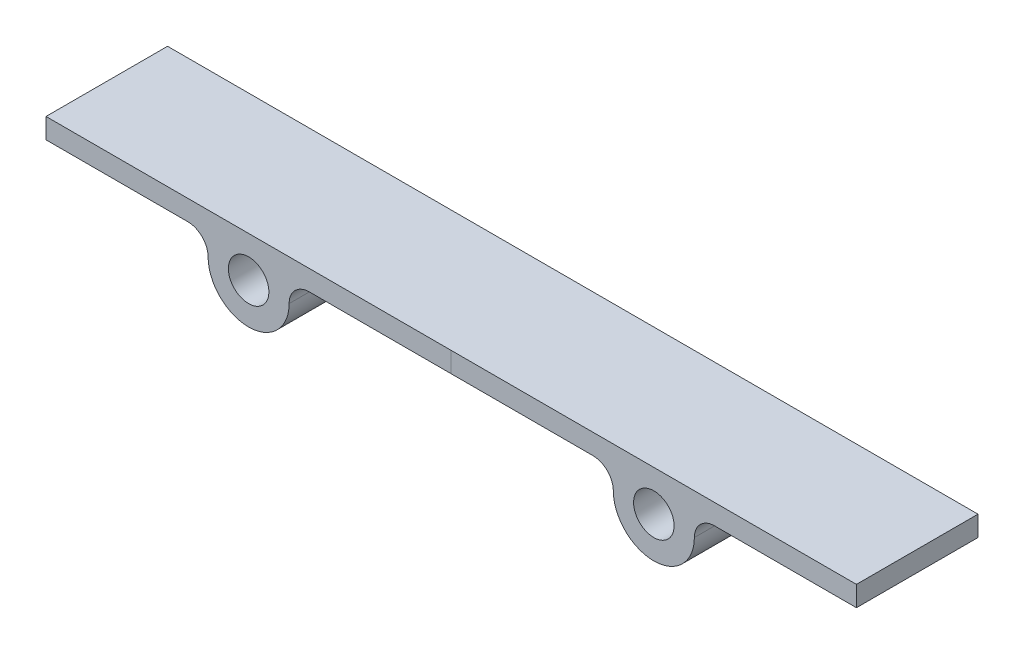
SolidWorks part; units mm, degrees
ref_plane "Front Plane" through (0, 0, 0) normal (0, 0, 1) x (1, 0, 0)
ref_plane "Top Plane" through (0, 0, 0) normal (0, 1, 0) x (1, 0, 0)
ref_plane "Right Plane" through (0, 0, 0) normal (1, 0, 0) x (0, 0, -1)
sketch "Sketch1" plane through (0, 0, 0) normal (0, 1, 0) x (1, 0, 0)
  line L0 (0, 0) -> (0, 95.1694) construction
  line L1 (0, 0) -> (117.2377, 0) construction
  line L3 (-200, 30) -> (200, 30)
  line L4 (-200, 30) -> (-200, -30)
  line L5 (-200, -30) -> (200, -30)
  line L6 (200, 30) -> (200, -30)
  dimension "D1" = 400
  dimension "D2" = 200
  dimension "D3" = 60
  dimension "D4" = 30
extrude "Extrude1" add sketch "Sketch1" against normal blind 10
sketch "Sketch2" plane through (0, -10, 0) normal (0, -1, 0) x (1, 0, 0)
  line L0 (0, 0) -> (-219.0879, 0) construction
  line L1 (-100, 30) -> (-100, -30) construction
  line L2 (-120, -30) -> (-80, -30)
  line L3 (-120, -30) -> (-120, 30)
  line L4 (-120, 30) -> (-80, 30)
  line L5 (-80, -30) -> (-80, 30)
  line L6 (0, 0) -> (0, -104.2356) construction
  line L7 (200, -30) -> (-200, -30) construction
  line L8 (-200, 30) -> (200, 30) construction
  dimension "D1" = 40
  dimension "D2" = 20
  dimension "D5" = 200
extrude "Extrude2" add sketch "Sketch2" along normal blind 30
fillet "Fillet1" radius 20 2 edges at (-80, -40, 0) (-120, -40, 0)
sketch "Sketch3" plane through (0, 0, -30) normal (0, 0, -1) x (1, 0, 0)
  circle A0 centre (-100, 20) radius 10
  arc A1 (-100, 40) -> (-120, 20) centre (-100, 20) ccw construction
  dimension "D1" = 20
extrude "Cut-Extrude1" cut sketch "Sketch3" against normal through all
fillet "Fillet2" radius 10 2 edges
mirror "Mirror1" about plane through (0, 0, 0) normal (1, 0, 0) of "Fillet2", "Extrude2", "Fillet1", "Cut-Extrude1"
sketch "Sketch4" plane through (0, 0, 0) normal (0, 1, 0) x (-1, 0, 0)
  line L0 (0, -30) -> (0, 30)
  line L1 (-200, -30) -> (200, -30) construction
  line L2 (200, 30) -> (-200, 30) construction
equation "\"D2@Sketch1\" = \"D1@Sketch1\"/2"
equation "\"D4@Sketch1\" = \"D3@Sketch1\"/2"
equation "\"D2@Sketch2\" = \"D1@Sketch2\"/2"
